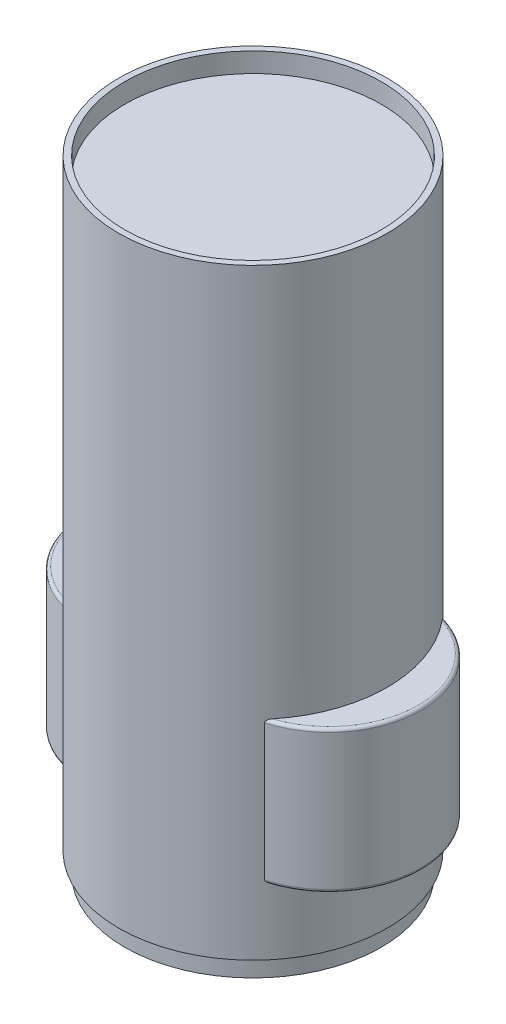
SolidWorks part; units mm, degrees
ref_plane "Front Plane" through (0, 0, 0) normal (0, 0, 1) x (1, 0, 0)
ref_plane "Top Plane" through (0, 0, 0) normal (0, 1, 0) x (1, 0, 0)
ref_plane "Right Plane" through (0, 0, 0) normal (1, 0, 0) x (0, 0, -1)
sketch "Sketch1" plane through (0, 0, 0) normal (1, 0, 0) x (0, 0, -1)
  line L0 (0, 0) -> (-42.5, 0)
  line L1 (-42.5, 0) -> (-42.5, 6.5)
  line L2 (-42.5, 6.5) -> (-44.5, 6.5)
  line L3 (-44.5, 6.5) -> (-44.5, 205.8)
  line L4 (-44.5, 205.8) -> (-42.5, 205.8)
  line L5 (-42.5, 205.8) -> (-42.5, 199.3)
  line L6 (-42.5, 199.3) -> (0, 199.3)
  line L7 (0, 199.3) -> (0, 0)
  line L8 (0, 29.9719) -> (0, 40.8779) construction
  dimension "D1" = 89
  dimension "D2" = 6.5
  dimension "D3" = 85
  dimension "D4" = 199.3
revolve "Revolve1" add sketch "Sketch1" angle 360 about L7
ref_plane "Plane1" through (0, 28.5, 0) normal (0, -1, 0) x (1, 0, 0)
sketch "Sketch2" plane through (0, 28.5, 0) normal (0, -1, 0) x (1, 0, 0)
  line L0 (25.15, 0) -> (-25.15, 0) construction
  arc A0 (0, -17.4309) -> (0, 17.4309) centre (25.15, 0) ccw
  arc A1 (0, 17.4309) -> (0, -17.4309) centre (-25.15, 0) ccw
  dimension "D2" = 61.2
  dimension "D1" = 50.3
extrude "Extrude1" add sketch "Sketch2" against normal blind 47.07
sketch "Sketch3" plane through (0, 75.57, 0) normal (0, 1, 0) x (-1, 0, 0)
  line L0 (48.03, 5) -> (48.03, -5)
  line L2 (48.03, 0) -> (20.5452, 0) construction
  arc A0 (48.03, -5) -> (44.9068, -5.0935) centre (46.467, -5) cw
  arc A2 (44.9068, 5.0935) -> (48.03, 5) centre (46.467, 5) cw
  arc A4 (44.9068, -5.0935) -> (44.2097, -5.0746) centre (44.5574, -5.1145) ccw
  circle A5 centre (0, 0) radius 44.5 construction
  arc A6 (44.2097, -5.0746) -> (44.2097, 5.0746) centre (0, 0) ccw
  arc A7 (44.9068, 5.0935) -> (44.2097, 5.0746) centre (44.5574, 5.1145) cw
  dimension "D2" = 10
  dimension "D3" = 1.563
  dimension "D4" = 0.7
  dimension "D1" = 48.03
extrude "Extrude2" add sketch "Sketch3" along normal blind 100
fillet "Fillet1" radius 1 4 edges at (55.75, 28.5, 0) (55.75, 75.57, 0) (-55.75, 28.5, 0) (-55.75, 75.57, 0)
